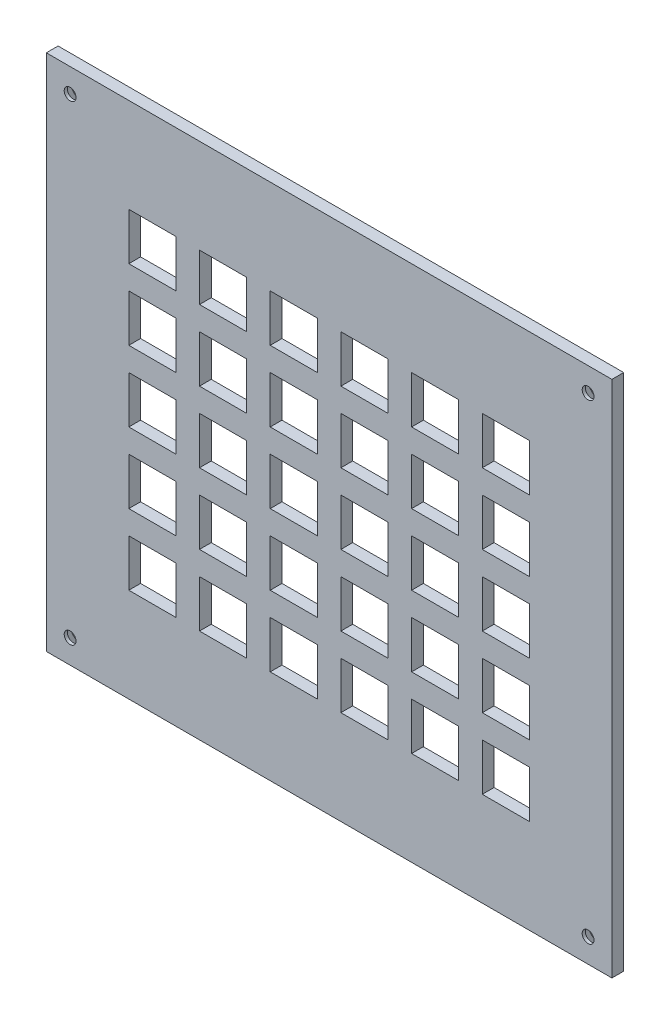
SolidWorks part; units mm, degrees
ref_plane "Front Plane" through (0, 0, 0) normal (0, 0, 1) x (1, 0, 0)
ref_plane "Top Plane" through (0, 0, 0) normal (0, 1, 0) x (1, 0, 0)
ref_plane "Right Plane" through (0, 0, 0) normal (1, 0, 0) x (0, 0, -1)
sketch "Sketch1" plane through (0, 0, 0) normal (0, 0, 1) x (1, 0, 0)
  line L1 (-76.2, 69.85) -> (76.2, 69.85)
  line L2 (-76.2, 69.85) -> (-76.2, -69.85)
  line L3 (-76.2, -69.85) -> (76.2, -69.85)
  line L4 (76.2, 69.85) -> (76.2, -69.85)
  line L5 (-76.2, 69.85) -> (76.2, -69.85) construction
  line L6 (-76.2, -69.85) -> (76.2, 69.85) construction
  point P0 (0, 0)
  dimension "D1" = 152.4
  dimension "D2" = 139.7
extrude "Boss-Extrude1" add sketch "Sketch1" along normal blind 3.175
sketch "Sketch3" plane through (0, 0, 3.175) normal (0, 0, 1) x (1, 0, 0)
  line L0 (-76.2, -69.85) -> (76.2, -69.85) construction
  line L1 (-53.975, -31.75) -> (-41.275, -31.75)
  line L2 (-53.975, -31.75) -> (-53.975, -44.45)
  line L3 (-53.975, -44.45) -> (-41.275, -44.45)
  line L4 (-41.275, -31.75) -> (-41.275, -44.45)
  line L5 (-53.975, -31.75) -> (-41.275, -44.45) construction
  line L6 (-53.975, -44.45) -> (-47.625, -38.1) construction
  line L7 (-76.2, 69.85) -> (-76.2, -69.85) construction
  line L8 (-34.925, -44.45) -> (-22.225, -44.45)
  line L9 (-22.225, -31.75) -> (-22.225, -44.45)
  line L10 (-34.925, -31.75) -> (-22.225, -31.75)
  line L11 (-34.925, -31.75) -> (-34.925, -44.45)
  line L12 (-15.875, -44.45) -> (-3.175, -44.45)
  line L13 (-3.175, -31.75) -> (-3.175, -44.45)
  line L14 (-15.875, -31.75) -> (-3.175, -31.75)
  line L15 (-15.875, -31.75) -> (-15.875, -44.45)
  line L16 (3.175, -44.45) -> (15.875, -44.45)
  line L17 (15.875, -31.75) -> (15.875, -44.45)
  line L18 (3.175, -31.75) -> (15.875, -31.75)
  line L19 (3.175, -31.75) -> (3.175, -44.45)
  line L20 (22.225, -44.45) -> (34.925, -44.45)
  line L21 (34.925, -31.75) -> (34.925, -44.45)
  line L22 (22.225, -31.75) -> (34.925, -31.75)
  line L23 (22.225, -31.75) -> (22.225, -44.45)
  line L24 (41.275, -44.45) -> (53.975, -44.45)
  line L25 (53.975, -31.75) -> (53.975, -44.45)
  line L26 (41.275, -31.75) -> (53.975, -31.75)
  line L27 (41.275, -31.75) -> (41.275, -44.45)
  line L28 (-34.925, -25.4) -> (-22.225, -25.4)
  line L29 (-22.225, -12.7) -> (-22.225, -25.4)
  line L30 (-34.925, -12.7) -> (-22.225, -12.7)
  line L31 (-34.925, -12.7) -> (-34.925, -25.4)
  line L32 (-15.875, -25.4) -> (-3.175, -25.4)
  line L33 (-3.175, -12.7) -> (-3.175, -25.4)
  line L34 (-15.875, -12.7) -> (-3.175, -12.7)
  line L35 (-15.875, -12.7) -> (-15.875, -25.4)
  line L36 (3.175, -25.4) -> (15.875, -25.4)
  line L37 (15.875, -12.7) -> (15.875, -25.4)
  line L38 (3.175, -12.7) -> (15.875, -12.7)
  line L39 (3.175, -12.7) -> (3.175, -25.4)
  line L40 (22.225, -25.4) -> (34.925, -25.4)
  line L41 (34.925, -12.7) -> (34.925, -25.4)
  line L42 (22.225, -12.7) -> (34.925, -12.7)
  line L43 (22.225, -12.7) -> (22.225, -25.4)
  line L44 (41.275, -25.4) -> (53.975, -25.4)
  line L45 (53.975, -12.7) -> (53.975, -25.4)
  line L46 (41.275, -12.7) -> (53.975, -12.7)
  line L47 (41.275, -12.7) -> (41.275, -25.4)
  line L48 (-34.925, -6.35) -> (-22.225, -6.35)
  line L49 (-22.225, 6.35) -> (-22.225, -6.35)
  line L50 (-34.925, 6.35) -> (-22.225, 6.35)
  line L51 (-34.925, 6.35) -> (-34.925, -6.35)
  line L52 (-15.875, -6.35) -> (-3.175, -6.35)
  line L53 (-3.175, 6.35) -> (-3.175, -6.35)
  line L54 (-15.875, 6.35) -> (-3.175, 6.35)
  line L55 (-15.875, 6.35) -> (-15.875, -6.35)
  line L56 (3.175, -6.35) -> (15.875, -6.35)
  line L57 (15.875, 6.35) -> (15.875, -6.35)
  line L58 (3.175, 6.35) -> (15.875, 6.35)
  line L59 (3.175, 6.35) -> (3.175, -6.35)
  line L60 (22.225, -6.35) -> (34.925, -6.35)
  line L61 (34.925, 6.35) -> (34.925, -6.35)
  line L62 (22.225, 6.35) -> (34.925, 6.35)
  line L63 (22.225, 6.35) -> (22.225, -6.35)
  line L64 (41.275, -6.35) -> (53.975, -6.35)
  line L65 (53.975, 6.35) -> (53.975, -6.35)
  line L66 (41.275, 6.35) -> (53.975, 6.35)
  line L67 (41.275, 6.35) -> (41.275, -6.35)
  line L68 (-34.925, 12.7) -> (-22.225, 12.7)
  line L69 (-22.225, 25.4) -> (-22.225, 12.7)
  line L70 (-34.925, 25.4) -> (-22.225, 25.4)
  line L71 (-34.925, 25.4) -> (-34.925, 12.7)
  line L72 (-15.875, 12.7) -> (-3.175, 12.7)
  line L73 (-3.175, 25.4) -> (-3.175, 12.7)
  line L74 (-15.875, 25.4) -> (-3.175, 25.4)
  line L75 (-15.875, 25.4) -> (-15.875, 12.7)
  line L76 (3.175, 12.7) -> (15.875, 12.7)
  line L77 (15.875, 25.4) -> (15.875, 12.7)
  line L78 (3.175, 25.4) -> (15.875, 25.4)
  line L79 (3.175, 25.4) -> (3.175, 12.7)
  line L80 (22.225, 12.7) -> (34.925, 12.7)
  line L81 (34.925, 25.4) -> (34.925, 12.7)
  line L82 (22.225, 25.4) -> (34.925, 25.4)
  line L83 (22.225, 25.4) -> (22.225, 12.7)
  line L84 (41.275, 12.7) -> (53.975, 12.7)
  line L85 (53.975, 25.4) -> (53.975, 12.7)
  line L86 (41.275, 25.4) -> (53.975, 25.4)
  line L87 (41.275, 25.4) -> (41.275, 12.7)
  line L88 (-34.925, 31.75) -> (-22.225, 31.75)
  line L89 (-22.225, 44.45) -> (-22.225, 31.75)
  line L90 (-34.925, 44.45) -> (-22.225, 44.45)
  line L91 (-34.925, 44.45) -> (-34.925, 31.75)
  line L92 (-15.875, 31.75) -> (-3.175, 31.75)
  line L93 (-3.175, 44.45) -> (-3.175, 31.75)
  line L94 (-15.875, 44.45) -> (-3.175, 44.45)
  line L95 (-15.875, 44.45) -> (-15.875, 31.75)
  line L96 (3.175, 31.75) -> (15.875, 31.75)
  line L97 (15.875, 44.45) -> (15.875, 31.75)
  line L98 (3.175, 44.45) -> (15.875, 44.45)
  line L99 (3.175, 44.45) -> (3.175, 31.75)
  line L100 (22.225, 31.75) -> (34.925, 31.75)
  line L101 (34.925, 44.45) -> (34.925, 31.75)
  line L102 (22.225, 44.45) -> (34.925, 44.45)
  line L103 (22.225, 44.45) -> (22.225, 31.75)
  line L104 (41.275, 31.75) -> (53.975, 31.75)
  line L105 (53.975, 44.45) -> (53.975, 31.75)
  line L106 (41.275, 44.45) -> (53.975, 44.45)
  line L107 (41.275, 44.45) -> (41.275, 31.75)
  line L108 (-53.975, -25.4) -> (-41.275, -25.4)
  line L109 (-41.275, -12.7) -> (-41.275, -25.4)
  line L110 (-53.975, -12.7) -> (-41.275, -12.7)
  line L111 (-53.975, -12.7) -> (-53.975, -25.4)
  line L112 (-53.975, -6.35) -> (-41.275, -6.35)
  line L113 (-41.275, 6.35) -> (-41.275, -6.35)
  line L114 (-53.975, 6.35) -> (-41.275, 6.35)
  line L115 (-53.975, 6.35) -> (-53.975, -6.35)
  line L116 (-53.975, 12.7) -> (-41.275, 12.7)
  line L117 (-41.275, 25.4) -> (-41.275, 12.7)
  line L118 (-53.975, 25.4) -> (-41.275, 25.4)
  line L119 (-53.975, 25.4) -> (-53.975, 12.7)
  line L120 (-53.975, 31.75) -> (-41.275, 31.75)
  line L121 (-41.275, 44.45) -> (-41.275, 31.75)
  line L122 (-53.975, 44.45) -> (-41.275, 44.45)
  line L123 (-53.975, 44.45) -> (-53.975, 31.75)
  line L124 (-34.925, -31.75) -> (-22.225, -44.45) construction
  line L125 (-34.925, -44.45) -> (-28.575, -38.1) construction
  point P0 (-47.625, -38.1)
  point P7 (-47.625, -44.45)
  dimension "D1" = 25.4
  dimension "D2" = 12.7
  dimension "D3" = 12.7
  dimension "D4" = 22.225
  dimension "D5" = 6
  dimension "D6" = 5
extrude "Cut-Extrude1" cut sketch "Sketch3" against normal through all
sketch "Sketch4" plane through (0, 0, 3.175) normal (0, 0, 1) x (1, 0, 0)
  line L0 (-76.2, -69.85) -> (76.2, 69.85) construction
  line L1 (-76.2, 69.85) -> (76.2, -69.85) construction
  line L2 (76.2, 69.85) -> (-76.2, 69.85) construction
  line L5 (-76.2, -69.85) -> (76.2, -69.85) construction
  point P8 (-65.8091, -60.325)
  point P9 (-65.8091, 60.325)
  point P10 (65.8091, 60.325)
  point P11 (65.8091, -60.325)
  dimension "D1" = 9.525
  dimension "D2" = 9.525
ref_plane "Plane1" through (0, -60.325, 0) normal (0, -1, 0) x (-1, 0, 0)
ref_plane "Plane2" through (0, 0, 1.5875) normal (0, 0, -1) x (-1, 0, 0)
ref_plane "Plane3" through (69.7865, 0, 0) normal (1, 0, 0) x (0, 0, -1)
sketch "Sketch5" plane through (69.7865, 0, 0) normal (1, 0, 0) x (0, 0, -1)
  line L0 (0, 63.4365) -> (-3.175, 63.4365) construction
  line L1 (0, -69.85) -> (0, 69.85) construction
  line L2 (-3.175, -69.85) -> (-3.175, 69.85) construction
  line L3 (-3.175, 69.85) -> (0, 69.85) construction
  line L4 (0, 63.4365) -> (0, 66.6432)
  line L5 (0, 66.6432) -> (-2.3292, 65.0265)
  line L6 (-2.3292, 65.0265) -> (-3.175, 65.0265)
  line L7 (-3.175, 65.0265) -> (-3.175, 63.4365)
  line L8 (-3.175, 63.4365) -> (0, 63.4365)
  dimension "D1" = 6.4135
  dimension "D2" = 6.4135
  dimension "D3" = 3.1801
  dimension "D4" = 2.3292
revolve "Cut-Revolve1" cut sketch "Sketch5" angle 360 about L0
mirror "Mirror1" about plane through (0, 0, 0) normal (1, 0, 0) of "Cut-Revolve1"
mirror "Mirror2" about plane through (0, 0, 0) normal (0, 1, 0) of "Mirror1", "Cut-Revolve1"
